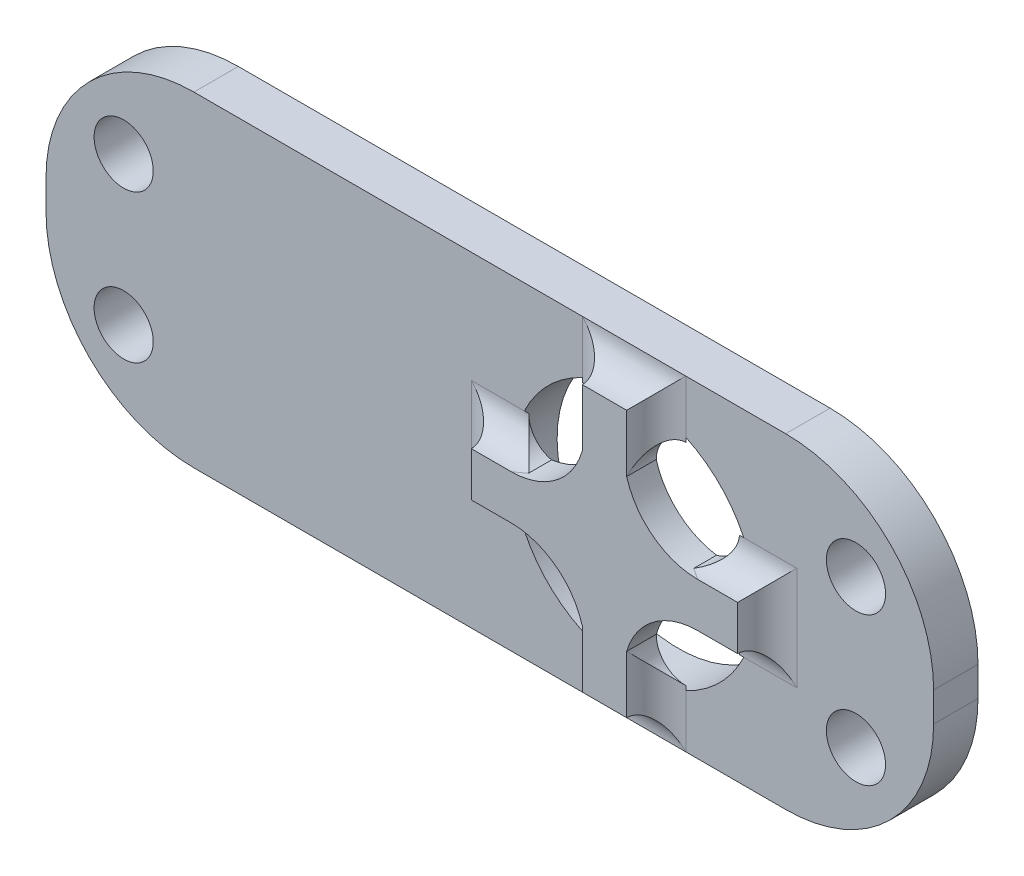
SolidWorks part; units mm, degrees
ref_plane "Front Plane" through (0, 0, 0) normal (0, 0, 1) x (1, 0, 0)
ref_plane "Top Plane" through (0, 0, 0) normal (0, 1, 0) x (1, 0, 0)
ref_plane "Right Plane" through (0, 0, 0) normal (1, 0, 0) x (0, 0, -1)
sketch "Sketch1" plane through (0, 0, 0) normal (0, 0, 1) x (1, 0, 0)
  line L0 (9.75, 30) -> (-30, 30) construction
  line L1 (-20, 41) -> (20, 41)
  line L2 (-30, 31) -> (-30, 29)
  line L3 (-20, 19) -> (20, 19)
  line L4 (30, 31) -> (30, 29)
  arc A0 (20, 41) -> (30, 31) centre (20, 31) cw
  arc A1 (20, 19) -> (30, 29) centre (20, 29) ccw
  arc A2 (-30, 29) -> (-20, 19) centre (-20, 29) ccw
  arc A3 (-20, 41) -> (-30, 31) centre (-20, 31) ccw
  circle A4 centre (9.75, 30) radius 8.2 construction
  circle A5 centre (9.75, 30) radius 8.2
  circle A6 centre (24.75, 25) radius 2 construction
  circle A7 centre (24.75, 35) radius 2 construction
  circle A8 centre (-24.75, 25) radius 2 construction
  circle A9 centre (-24.75, 35) radius 2 construction
  circle A10 centre (24.75, 25) radius 2
  circle A11 centre (24.75, 35) radius 2
  circle A12 centre (-24.75, 25) radius 2
  circle A13 centre (-24.75, 35) radius 2
  point P7 (0, 41)
  point P9 (-30, 30)
  point P10 (0, 0)
  dimension "D3" = 10
  dimension "D1" = 22
  dimension "D2" = 60
extrude "Boss-Extrude1" add sketch "Sketch1" along normal blind 3
sketch "Sketch2" plane through (0, 0, 3) normal (0, 0, 1) x (1, 0, 0)
  line L0 (-30, 30) -> (30, 30) construction
  line L1 (-30, 31) -> (-30, 29) construction
  line L2 (30, 29) -> (30, 31) construction
  line L4 (0.75, 28.5) -> (18.75, 28.5)
  line L5 (0.75, 28.5) -> (0.75, 31.5)
  line L6 (0.75, 31.5) -> (18.75, 31.5)
  line L7 (18.75, 28.5) -> (18.75, 31.5)
  line L8 (0.75, 28.5) -> (18.75, 31.5) construction
  line L9 (0.75, 31.5) -> (18.75, 28.5) construction
  point P6 (9.75, 30)
  point P12 (0, 0)
  dimension "D1" = 3
  dimension "D2" = 18
extrude "Boss-Extrude3" add sketch "Sketch2" along normal blind 2
fillet "Fillet1" radius 2 6 edges at (1.2192, 31.5, 3) (18.2808, 31.5, 3) (18.2808, 28.5, 3) (1.2192, 28.5, 3) (0.75, 30, 3) (18.75, 30, 3)
fillet "Fillet2" radius 2 2 edges at (17.8116, 28.5, 4) (1.6884, 28.5, 4)
fillet "Fillet3" radius 2 2 edges at (1.6884, 31.5, 4) (17.8116, 31.5, 4)
pattern_circular "CirPattern1" count 2 over 270 about axis through (9.75, 30, 0) along (0, 0, 1) of "Boss-Extrude3", "Fillet1", "Fillet3", "Fillet2"
fillet "Fillet4" radius 5 4 edges at (11.25, 28.5, 4) (8.25, 28.5, 4) (11.25, 31.5, 4) (8.25, 31.5, 4)
